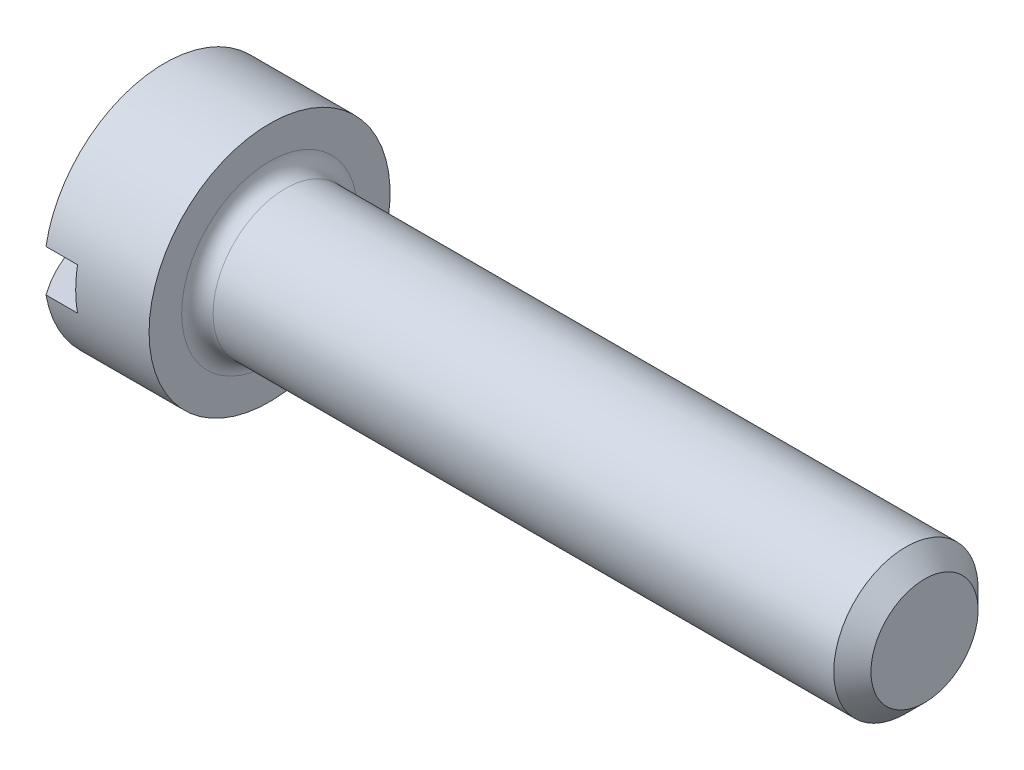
SolidWorks part; units mm, degrees
ref_plane "Plane1" through (0, 0, 0) normal (0, 0, 1) x (1, 0, 0)
ref_plane "Plane2" through (0, 0, 0) normal (0, 1, 0) x (1, 0, 0)
ref_plane "Plane3" through (0, 0, 0) normal (1, 0, 0) x (0, 0, -1)
sketch "BodySke" plane through (0, 0, 0) normal (0, 0, 1) x (1, 0, 0)
  line L0 (1.397, 0.6998) -> (1.397, 1.1684)
  line L1 (1.651, 1.1684) -> (1.651, -0.3023) construction
  line L2 (-25.4, 0) -> (127, 0) construction
  line L3 (7.747, 0) -> (0, 0)
  line L4 (1.397, 0.6998) -> (7.5667, 0.6998)
  line L5 (7.747, 0.5194) -> (7.747, 0)
  line L6 (0.38, 1.1684) -> (1.397, 1.1684)
  line L7 (5.7743, 1.1684) -> (5.7743, -0.3023) construction
  line L8 (7.5667, 0.6998) -> (7.747, 0.5194)
  arc A0 (0.38, 1.1684) -> (0, 0) centre (1.9863, 0) ccw
  dimension "Crown_rad" = 1.9863
  dimension "Head_ht" = 1.397
  dimension "Diameter" = 1.3995
  dimension "Length" = 6.35
  dimension "Head_dia" = 2.3368
  dimension "Minor_dia" = 1.0389
  dimension "D7" = 45
  dimension "Advance" = 0.254
  dimension "Thread_nom" = 1.9727
revolve "Base-Revolve" add sketch "BodySke"
fillet "Fillet1" radius 0.1524 1 edges at (1.397, 0, 0.6998)
ref_plane "Plane4" through (0.6858, 0, 0) normal (1, 0, 0) x (0, 0, -1)
sketch "Sketch2" plane through (0.6858, 0, 0) normal (1, 0, 0) x (0, 0, -1)
  line L0 (1.1684, -0.2032) -> (-1.1684, -0.2032)
  line L1 (1.1684, -0.2032) -> (1.1684, 0.2032)
  line L2 (-1.1684, 0.2032) -> (1.1684, 0.2032)
  line L3 (-1.1684, 0.2032) -> (-1.1684, -0.2032)
  dimension "D1" = 2.3368
  dimension "D2" = 1.1684
  dimension "Slot_width" = 0.4064
  dimension "D3" = 0.2032
extrude "Slot" cut sketch "Sketch2" against normal through all
sketch "ThdSchSke" plane through (0, 0, 0) normal (0, 0, 1) x (1, 0, 0)
  line L0 (5.7743, -0.5194) -> (5.648, -0.6998)
  line L1 (5.7743, -0.5194) -> (5.9006, -0.6998)
  line L2 (5.9006, -0.6998) -> (5.9006, -0.8747)
  line L3 (-3.175, 0) -> (5.1513, 0) construction
  line L5 (5.9006, -0.8747) -> (5.648, -0.8747)
  line L6 (5.648, -0.8747) -> (5.648, -0.6998)
  dimension "Thread_minor" = 1.0389
  dimension "Diameter" = 1.3995
  dimension "Start" = 5.7743
  dimension "SideAngle" = 55
  dimension "VeeAngle" = 70
  dimension "Overcut" = 1.7494
revolve "ThreadSchematic" [suppressed] cut sketch "ThdSchSke" angle 360 about L3
pattern_linear "ThdSchPat" [suppressed]
equation "\"D1@Sketch2\" = \"Head_dia@BodySke\""
equation "\"D2@Sketch2\" = \"D1@Sketch2\" / 2"
equation "\"D3@Sketch2\" = \"Slot_width@Sketch2\" / 2"
equation "\"Thread_minor@ThreadCosmetic\" = \"Minor_dia@BodySke\""
equation "\"Crown_rad@BodySke\" = \"Head_dia@BodySke\" * 0.85"
equation "\"Thread_length@ThreadCosmetic\" = ((sgn( (\"Length@BodySke\" - \"Advance@BodySke\" ) - \"Thread_nom@BodySke\" )-1)*( (\"Length@BodySke\" - \"Advance@BodySke\" ) - \"Thread_nom@BodySke\" ))/-2+ \"Thread_nom@BodySke\""
equation "\"Thread_minor@ThdSchSke\" = \"Minor_dia@BodySke\""
equation "\"Diameter@ThdSchSke\" = \"Diameter@BodySke\""
equation "\"Overcut@ThdSchSke\" = \"Diameter@BodySke\" * 1.25"
equation "\"Start@ThdSchSke\" = \"Head_ht@BodySke\" + \"Length@BodySke\" - \"Thread_length@ThreadCosmetic\"  '---Non-countersunk---"
equation "\"Num_threads@ThdSchPat\" = int( \"Thread_length@ThreadCosmetic\" / \"Advance@BodySke\" + 0.999 )  + 1"
equation "\"Advance@ThdSchPat\" = \"Thread_length@ThreadCosmetic\" /  (\"Num_threads@ThdSchPat\" - 1) 'relax it"
equation "\"Num_threads@ThdSchPat\" = \"Num_threads@ThdSchPat\" - sgn( \"Num_threads@ThdSchPat\" - 1) '---chamfered tips only---"
